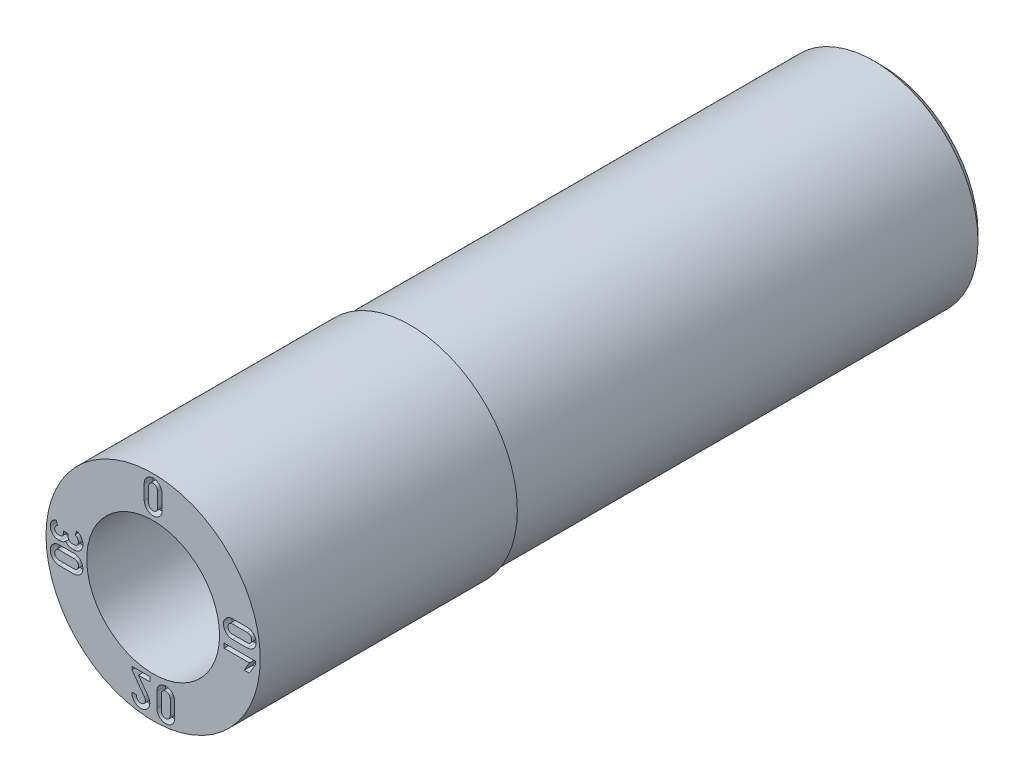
SolidWorks part; units mm, degrees
ref_plane "Front Plane" through (0, 0, 0) normal (0, 0, 1) x (1, 0, 0)
ref_plane "Top Plane" through (0, 0, 0) normal (0, 1, 0) x (1, 0, 0)
ref_plane "Right Plane" through (0, 0, 0) normal (1, 0, 0) x (0, 0, -1)
sketch "Sketch1" plane through (0, 0, 0) normal (1, 0, 0) x (0, 0, -1)
  line L2 (0, 2.5) -> (0, 1.55)
  line L3 (16.75, 2.5) -> (0, 2.5)
  line L4 (-3.7979, 0) -> (49996.2021, 0) construction
  line L8 (14, 0.8) -> (2.8, 0.8)
  line L9 (2.8, 1.55) -> (2.8, 0.8)
  line L10 (2.8, 1.55) -> (0, 1.55)
  line L12 (17, 1.5) -> (17, 2.25)
  line L16 (17, 2.25) -> (16.75, 2.5)
  line L17 (17, 1.5) -> (14, 1.5)
  line L18 (14, 0.8) -> (14, 1.5)
  dimension "D1" = 17
  dimension "D2" = 45
  dimension "D3" = 0.25
  dimension "D4" = 5
  dimension "D5" = 3.1
  dimension "D6" = 2.8
  dimension "D7" = 1.6
  dimension "D8" = 3
  dimension "D9" = 3
revolve "Revolve1" add sketch "Sketch1" angle 360 about L4
sketch "Sketch4" plane through (0, 0, 0) normal (1, 0, 0) x (0, 0, -1)
  line L0 (0, 0) -> (50000, 0) construction
  line L1 (17, -2.25) -> (17, 2.25) construction
  line L2 (6, 3.435) -> (17, 3.435)
  line L3 (6, 3.435) -> (6, 2.435)
  line L4 (6, 2.435) -> (17, 2.435)
  line L5 (17, 3.435) -> (17, 2.435)
  line L6 (16.75, 2.5) -> (0, 2.5) construction
  line L7 (0, 2.5) -> (0, -2.5) construction
  dimension "D1" = 1
  dimension "D2" = 0.065
  dimension "D3" = 6
revolve "Cut-Revolve1" cut sketch "Sketch4" angle 360 about L0
sketch "Sketch2" plane through (0, 0, 0) normal (0, 0, 1) x (1, 0, 0)
  line L292 (-2.1921, -0.037) -> (-1.8475, -0.0371)
  line L293 (-1.8475, -0.4549) -> (-2.1922, -0.4549)
  line L294 (-1.8475, -0.3505) -> (-2.1921, -0.3504)
  line L295 (-2.1921, -0.1415) -> (-1.8474, -0.1415)
  line L296 (0.1054, 1.8521) -> (0.1054, 2.1968)
  line L297 (-0.1035, 2.1968) -> (-0.1035, 1.8521)
  line L298 (-0.208, 2.1968) -> (-0.208, 1.8521)
  line L299 (0.2098, 1.8521) -> (0.2099, 2.1968)
  line L300 (-0.0779, -1.7472) -> (-0.078, -1.6427)
  line L301 (-0.078, -1.6427) -> (-0.4957, -1.6427)
  line L302 (-0.4957, -1.6427) -> (-0.4957, -1.7118)
  line L303 (-0.4957, -1.7118) -> (-0.202, -2.1195)
  line L304 (-0.3901, -2.1649) -> (-0.4951, -2.1649)
  line L305 (-0.1171, -2.0584) -> (-0.3443, -1.7472)
  line L306 (-0.3443, -1.7472) -> (-0.0779, -1.7472)
  line L307 (2.388, -0.0984) -> (2.388, -0.1671)
  line L308 (2.388, -0.1671) -> (2.2474, -0.4117)
  line L309 (2.2474, -0.4117) -> (2.127, -0.4117)
  line L310 (2.127, -0.4117) -> (2.247, -0.2028)
  line L311 (2.247, -0.2028) -> (1.6569, -0.2029)
  line L312 (1.6569, -0.2029) -> (1.6569, -0.0984)
  line L313 (1.6569, -0.0984) -> (2.388, -0.0984)
  line L314 (1.8508, 0.1773) -> (2.1955, 0.1773)
  line L315 (2.1955, 0.3862) -> (1.8508, 0.3862)
  line L316 (2.1955, 0.4906) -> (1.8508, 0.4906)
  line L317 (1.8508, 0.0728) -> (2.1955, 0.0728)
  line L318 (-1.8472, 0.1371) -> (-1.8838, 0.1371)
  line L319 (-1.9882, 0.2416) -> (-1.9882, 0.2938)
  line L320 (-1.9882, 0.2938) -> (-2.0926, 0.2938)
  line L321 (-2.0926, 0.2938) -> (-2.0926, 0.2416)
  line L322 (-2.1762, 0.1581) -> (-2.2127, 0.1581)
  line L323 (-2.2324, 0.3307) -> (-2.2658, 0.4296)
  line L324 (-2.2127, 0.0536) -> (-2.1762, 0.0536)
  line L325 (-1.8838, 0.0327) -> (-1.8472, 0.0327)
  line L326 (-1.7804, 0.4505) -> (-1.8188, 0.3533)
  line L327 (0.5043, -2.2004) -> (0.5043, -1.8557)
  line L328 (0.0865, -1.8557) -> (0.0865, -2.2004)
  line L329 (0.1909, -1.8557) -> (0.191, -2.2004)
  line L330 (0.3998, -2.2004) -> (0.3999, -1.8557)
  arc A136 (-1.8475, -0.4549) -> (-1.8475, -0.0371) centre (-1.8475, -0.246) ccw
  arc A137 (-2.1921, -0.037) -> (-2.1922, -0.4549) centre (-2.1921, -0.246) ccw
  arc A138 (-1.8475, -0.3505) -> (-1.8474, -0.1415) centre (-1.8475, -0.246) ccw
  arc A139 (-2.1921, -0.1415) -> (-2.1921, -0.3504) centre (-2.1921, -0.246) ccw
  arc A140 (-0.1035, 1.8521) -> (0.1054, 1.8521) centre (0.0009, 1.8521) ccw
  arc A141 (0.1054, 2.1968) -> (-0.1035, 2.1968) centre (0.0009, 2.1968) ccw
  arc A142 (-0.208, 1.8521) -> (0.2098, 1.8521) centre (0.0009, 1.8521) ccw
  arc A143 (0.2099, 2.1968) -> (-0.208, 2.1968) centre (0.0009, 2.1968) ccw
  arc A144 (-0.3901, -2.1649) -> (-0.202, -2.1195) centre (-0.2868, -2.1806) ccw
  arc A145 (-0.4951, -2.1649) -> (-0.1171, -2.0584) centre (-0.2867, -2.1805) ccw
  arc A146 (1.8508, 0.3862) -> (1.8508, 0.1773) centre (1.8508, 0.2817) ccw
  arc A147 (2.1955, 0.1773) -> (2.1955, 0.3862) centre (2.1955, 0.2817) ccw
  arc A148 (1.8508, 0.4906) -> (1.8508, 0.0728) centre (1.8508, 0.2817) ccw
  arc A149 (2.1955, 0.0728) -> (2.1955, 0.4906) centre (2.1955, 0.2817) ccw
  arc A150 (-1.7427, 0.2416) -> (-1.8188, 0.3533) centre (-1.8629, 0.2416) ccw
  arc A151 (-1.8472, 0.1371) -> (-1.7427, 0.2416) centre (-1.8472, 0.2416) ccw
  arc A152 (-1.9882, 0.2416) -> (-1.8838, 0.1371) centre (-1.8837, 0.2416) ccw
  arc A153 (-2.1762, 0.1581) -> (-2.0926, 0.2416) centre (-2.1762, 0.2416) ccw
  arc A154 (-2.2963, 0.2416) -> (-2.2127, 0.1581) centre (-2.2127, 0.2417) ccw
  arc A155 (-2.2324, 0.3307) -> (-2.2963, 0.2416) centre (-2.2024, 0.2417) ccw
  arc A156 (-2.2658, 0.4296) -> (-2.4007, 0.2416) centre (-2.2022, 0.2416) ccw
  arc A157 (-2.4007, 0.2416) -> (-2.2127, 0.0536) centre (-2.2128, 0.2416) ccw
  arc A158 (-2.1762, 0.0536) -> (-2.0442, 0.1078) centre (-2.1762, 0.2415) ccw
  arc A159 (-2.0442, 0.1078) -> (-1.8838, 0.0327) centre (-1.8838, 0.2415) ccw
  arc A160 (-1.8472, 0.0327) -> (-1.6383, 0.2416) centre (-1.8472, 0.2415) ccw
  arc A161 (-1.6383, 0.2416) -> (-1.7804, 0.4505) centre (-1.8629, 0.2415) ccw
  arc A162 (0.5043, -1.8557) -> (0.0865, -1.8557) centre (0.2954, -1.8557) ccw
  arc A163 (0.0865, -2.2004) -> (0.5043, -2.2004) centre (0.2954, -2.2004) ccw
  arc A164 (0.3999, -1.8557) -> (0.1909, -1.8557) centre (0.2954, -1.8557) ccw
  arc A165 (0.191, -2.2004) -> (0.3998, -2.2004) centre (0.2954, -2.2004) ccw
  point P565 (0, 0.0042)
  point P566 (0.0042, 0.0042)
  point P567 (0.0042, 0)
extrude "Cut-Extrude1" cut sketch "Sketch2" against normal blind 0.2
sketch "Sketch3" plane through (0, 0, -2.8) normal (0, 0, 1) x (1, 0, 0)
  line L0 (0, 0) -> (0, 50000) construction
  line L1 (0.4619, 0.8) -> (-0.4619, 0.8)
  line L2 (-0.4619, 0.8) -> (-0.9238, 0)
  line L3 (-0.9238, 0) -> (-0.4619, -0.8)
  line L4 (-0.4619, -0.8) -> (0.4619, -0.8)
  line L5 (0.4619, -0.8) -> (0.9238, 0)
  line L6 (0.9238, 0) -> (0.4619, 0.8)
  line L7 (0, 0) -> (50000, 0) construction
  circle A0 centre (0, 0) radius 0.8 construction
  circle A1 centre (0, 0) radius 0.8 construction
extrude "Cut-Extrude2" cut sketch "Sketch3" against normal blind 1.4
